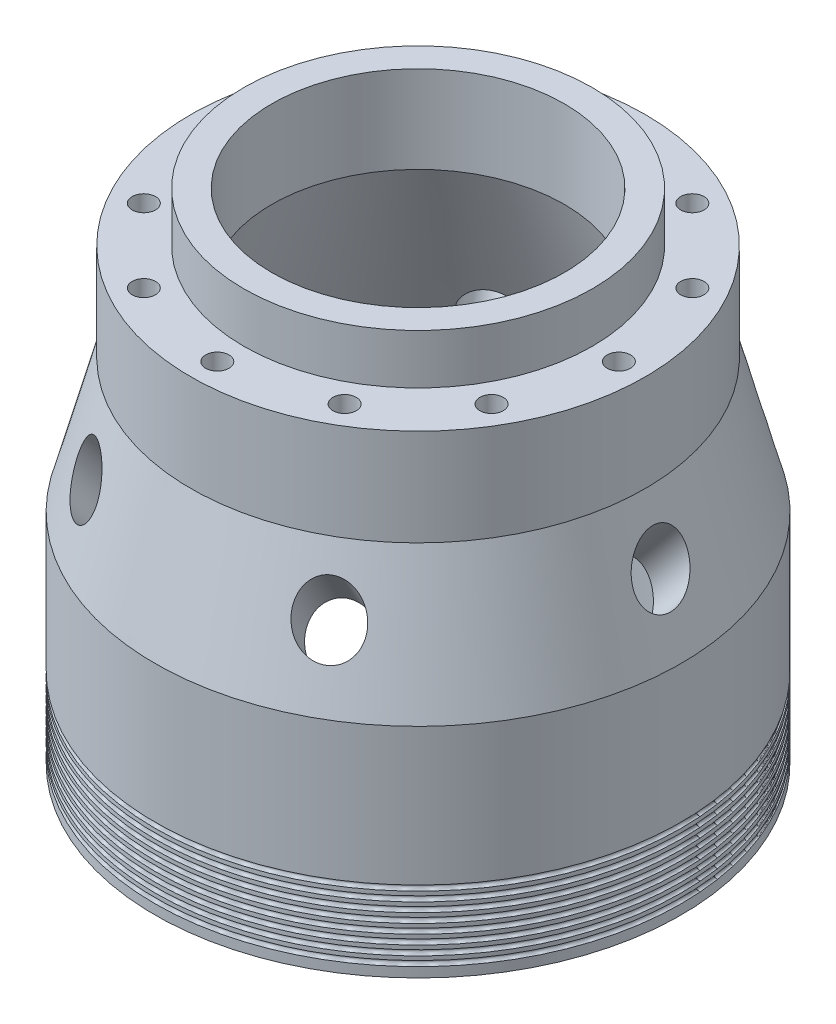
SolidWorks part; units mm, degrees
ref_plane "Front" through (0, 0, 0) normal (0, 0, 1) x (1, 0, 0)
ref_plane "Top" through (0, 0, 0) normal (0, 1, 0) x (1, 0, 0)
ref_plane "Right" through (0, 0, 0) normal (1, 0, 0) x (0, 0, -1)
sketch "Sketch1" plane through (0, 0, 0) normal (1, 0, 0) x (0, 0, -1)
  line L0 (0, 0) -> (0, 683.6466) construction
  line L1 (422.5, 0) -> (422.5, 350)
  line L2 (422.5, 350) -> (365, 564.5929)
  line L3 (365, 564.5929) -> (365, 720)
  line L4 (365, 720) -> (280, 720)
  line L5 (280, 720) -> (280, 800)
  line L6 (280, 800) -> (235, 800)
  line L7 (235, 800) -> (235, 660)
  line L8 (235, 660) -> (380, 261.6158)
  line L9 (380, 261.6158) -> (380, 0)
  line L10 (380, 0) -> (422.5, 0)
  dimension "D1" = 800
  dimension "D2" = 845
  dimension "D3" = 760
  dimension "D4" = 470
  dimension "D5" = 730
  dimension "D6" = 560
  dimension "D7" = 350
  dimension "D8" = 80
  dimension "D9" = 15
  dimension "D10" = 20
  dimension "D11" = 140
revolve "Revolve1" add sketch "Sketch1" angle 360 about L0
hole_wizard "M42 Tapped Hole1" positions "Sketch2" profile "Sketch3" tap size "M42" standard "ISO"
sketch "Sketch2" plane through (0, 720, 0) normal (0, 1, 0) x (1, 0, 0)
  circle A0 centre (0, 0) radius 322.5 construction
  point P0 (0, 322.5)
  dimension "D1" = 645
sketch "Sketch3" plane through (0, 720, -322.5) normal (1, 0, 0) x (0, 0, 1)
  line L0 (0, 0) -> (0, 108.7661)
  line L1 (0, 108.7661) -> (18.75, 97.5)
  line L2 (18.75, 97.5) -> (18.75, 0)
  line L5 (18.75, 0) -> (0, 0)
  line L10 (0, 108.7661) -> (-18.75, 97.5) construction
  line L11 (0, -6.35) -> (0, 107.95) construction
  dimension "Tap Drill Dia." = 37.5
  dimension "Tap Drill Depth" = 97.5
  dimension "Drill Angle" = 118
pattern_circular "CirPattern1" count 12 over 360 about axis through (0, 0, 0) along (0, 1, 0) of "M42 Tapped Hole1"
sketch "Sketch4" plane through (0, 0, 0) normal (0, 0, 1) x (1, 0, 0)
  line L0 (0, 0) -> (-429.9103, 512.3472) construction
  line L1 (-380, 0) -> (380, 0) construction
  line L2 (-417.0332, 497.0008) -> (-314.7497, 375.104)
  line L3 (-417.0332, 497.0008) -> (-451.5052, 468.0754)
  line L4 (-314.7497, 375.104) -> (-349.2217, 346.1786)
  line L5 (-451.5052, 468.0754) -> (-349.2217, 346.1786)
  line L6 (-380, 261.6158) -> (-235, 660)
  line L7 (235, 660) -> (380, 261.6158)
  line L9 (-380, 261.6158) -> (-235, 660) construction
  line L10 (-365, 564.5929) -> (-422.5, 350)
  line L11 (422.5, 350) -> (365, 564.5929)
  line L13 (-365, 564.5929) -> (-422.5, 350) construction
  point P20 (-391.3217, 466.359)
  dimension "D1" = 50
  dimension "D2" = 90
  dimension "D3" = 40
revolve "Cut-Revolve1" cut sketch "Sketch4" angle 360 about L0
pattern_circular "CirPattern2" count 6 over 360 about axis through (0, 0, 0) along (0, -1, 0) of "Cut-Revolve1"
sketch "Sketch5" plane through (0, 0, 0) normal (0, 0, 1) x (1, 0, 0)
  line L0 (-422.5, 350) -> (-422.5, 0) construction
  line L1 (-422.5, 0) -> (422.5, 0) construction
  line L2 (0, 0) -> (0, 47.1143) construction
  circle A0 centre (-422.5, 20) radius 4.25
  dimension "D1" = 8.5
  dimension "D2" = 20
revolve "Cut-Revolve2" cut sketch "Sketch5" angle 360 about L2
pattern_linear "LPattern1" count 8 spacing 15 along (0, 1, 0) of "Cut-Revolve2"
